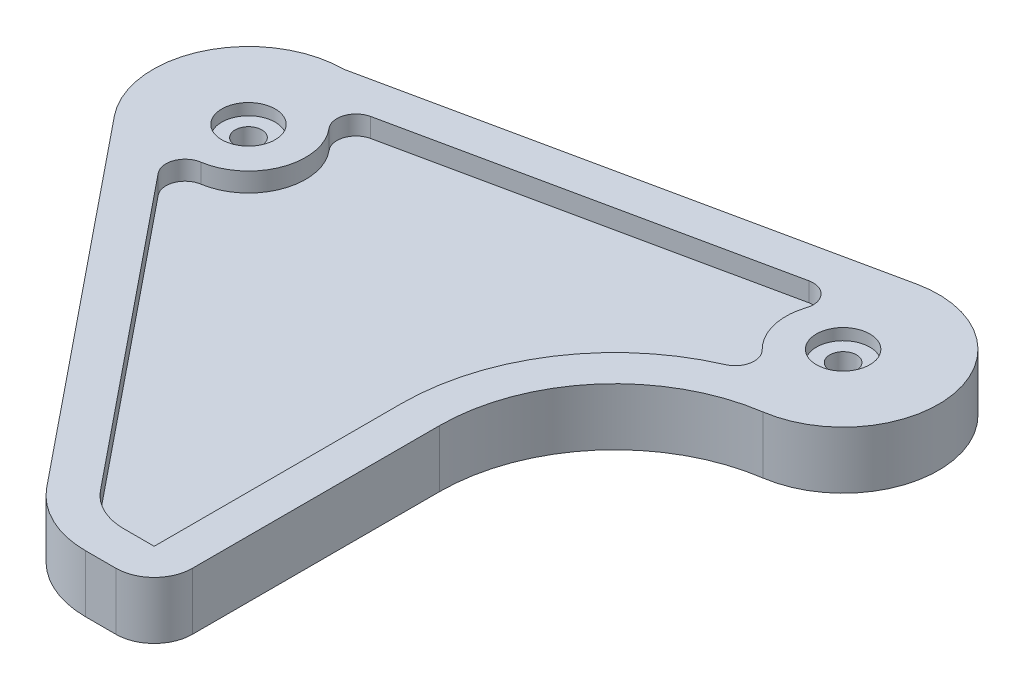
SolidWorks part; units mm, degrees
ref_plane "Front Plane" through (0, 0, 0) normal (0, 0, 1) x (1, 0, 0)
ref_plane "Top Plane" through (0, 0, 0) normal (0, 1, 0) x (1, 0, 0)
ref_plane "Right Plane" through (0, 0, 0) normal (1, 0, 0) x (0, 0, -1)
sketch "Sketch1" plane through (0, 0, 0) normal (0, 1, 0) x (1, 0, 0)
  line L0 (0, 25) -> (123.8022, 51.315)
  line L1 (55.9936, -108.8717) -> (-19.4286, -15.733)
  line L2 (75.4222, -118.1387) -> (83.4222, -118.1387)
  line L3 (93.4222, -43.3696) -> (93.4222, -108.1387)
  arc A0 (0, 25) -> (-19.4286, -15.733) centre (0, 0) ccw
  arc A1 (123.8022, 51.315) -> (132.6698, 2.1321) centre (129, 26.8613) cw
  arc A2 (132.6698, 2.1321) -> (93.4222, -43.3696) centre (139.4222, -43.3696) ccw
  arc A3 (55.9936, -108.8717) -> (75.4222, -118.1387) centre (75.4222, -93.1387) ccw
  arc A4 (83.4222, -118.1387) -> (93.4222, -108.1387) centre (83.4222, -108.1387) ccw
  point P13 (63.4979, -118.1387)
  dimension "D1" = 46
  dimension "D2" = 25
  dimension "D3" = 25
  dimension "D8" = 25
  dimension "D6" = 10
  dimension "D4" = 145
  dimension "D5" = 129
  dimension "D7" = 63
  dimension "D9" = 18
  dimension "D10" = 129
extrude "Extrude1" add sketch "Sketch1" along normal blind 15
sketch "Sketch3" plane through (0, 15, 0) normal (0, 1, 0) x (-1, 0, 0)
  line L0 (-125.8813, -41.5335) -> (-0.9186, -14.9718) construction
  line L1 (11.6572, 9.4398) -> (-63.7651, 102.5785) construction
  line L3 (-108.9393, -37.9324) -> (-14.2344, -17.8022)
  line L6 (0.757, 22.9004) -> (-63.7651, 102.5785)
  line L7 (-75.4222, 108.1387) -> (-83.4222, 108.1387)
  line L8 (-83.4222, 108.1387) -> (-83.4222, 43.3696)
  line L9 (19.4286, 15.733) -> (-55.9936, 108.8717)
  line L10 (-75.4222, 118.1387) -> (-83.4222, 118.1387)
  line L11 (-93.4222, 108.1387) -> (-93.4222, 43.3696)
  line L12 (-123.8022, -51.315) -> (0, -25)
  line L13 (19.4286, 15.733) -> (-55.9936, 108.8717)
  line L14 (-75.4222, 118.1387) -> (-83.4222, 118.1387)
  line L15 (-93.4222, 108.1387) -> (-93.4222, 43.3696)
  line L16 (-123.8022, -51.315) -> (0, -25)
  arc A0 (-14.2344, -17.8022) -> (-11.4555, -9.6836) centre (-15.274, -12.9115) ccw
  arc A1 (-2.3465, 14.8153) -> (0.757, 22.9004) centre (-3.1287, 19.7538) ccw
  arc A3 (-131.2019, -12.0238) -> (-83.4222, 43.3696) centre (-139.4222, 43.3696) ccw construction
  arc A4 (-63.7651, 102.5785) -> (-75.4222, 108.1387) centre (-75.4222, 93.1387) ccw
  arc A5 (-83.4222, 108.1387) -> (-83.4222, 108.1387) centre (-83.4222, 108.1387) ccw
  arc A6 (-117.0345, -7.9606) -> (-83.4222, 43.3696) centre (-139.4222, 43.3696) ccw
  arc A7 (-117.0345, -7.9606) -> (-118.5267, -16.123) centre (-115.0356, -12.5436) ccw
  arc A8 (0, -25) -> (19.4286, 15.733) centre (0, 0) ccw
  arc A9 (-55.9936, 108.8717) -> (-75.4222, 118.1387) centre (-75.4222, 93.1387) ccw
  arc A10 (-83.4222, 118.1387) -> (-93.4222, 108.1387) centre (-83.4222, 108.1387) ccw
  arc A11 (-132.6698, -2.1321) -> (-93.4222, 43.3696) centre (-139.4222, 43.3696) ccw
  arc A12 (-132.6698, -2.1321) -> (-123.8022, -51.315) centre (-129, -26.8613) ccw
  arc A13 (0, -25) -> (19.4286, 15.733) centre (0, 0) ccw
  arc A14 (-55.9936, 108.8717) -> (-75.4222, 118.1387) centre (-75.4222, 93.1387) ccw
  arc A15 (-83.4222, 118.1387) -> (-93.4222, 108.1387) centre (-83.4222, 108.1387) ccw
  arc A16 (-132.6698, -2.1321) -> (-93.4222, 43.3696) centre (-139.4222, 43.3696) ccw
  arc A17 (-132.6698, -2.1321) -> (-123.8022, -51.315) centre (-129, -26.8613) ccw
  arc A18 (-2.3465, 14.8153) -> (-11.4555, -9.6836) centre (0, 0) ccw
  arc A19 (-114.7342, -31.4965) -> (-118.5267, -16.123) centre (-129, -26.8613) ccw
  arc A20 (-0.9186, -14.9718) -> (11.6572, 9.4398) centre (0, 0) ccw construction
  arc A21 (-131.2019, -12.0238) -> (-125.8813, -41.5335) centre (-129, -26.8613) ccw construction
  arc A22 (-108.9393, -37.9324) -> (-114.7342, -31.4965) centre (-109.9789, -33.0416) cw
  dimension "D1" = 0
  dimension "D2" = 10
  dimension "D3" = 5
  dimension "D4" = 15
  dimension "D5" = 15
extrude "Cut-Extrude1" cut sketch "Sketch3" against normal blind 5 contours A22 L3 A0 A18 A1 L6 A4 L7 L8 A6 A7 A19
hole_wizard "C.Bore Holes" positions "Sketch8" profile "Sketch7" counterbore size "#00" standard "Ansi Inch"
sketch "Sketch8" plane through (0, 15, 0) normal (0, 1, 0) x (-1, 0, 0)
  arc A0 (0, -25) -> (19.4286, 15.733) centre (0, 0) ccw construction
  point P0 (0, 0)
  point P1 (-129, -26.8613)
sketch "Sketch7" plane through (0, 15, 0) normal (1, 0, 0) x (0, 0, 1)
  line L0 (0, 0) -> (0, 15)
  line L1 (0, 15) -> (3.5, 15)
  line L3 (3.5, 15) -> (3.5, 3)
  line L4 (3.5, 3) -> (7, 3)
  line L5 (7, 3) -> (7, 0)
  line L7 (7, 0) -> (0, 0)
  line L11 (0, -6.35) -> (0, 107.95) construction
  dimension "Thru Hole Dia." = 7
  dimension "Thru Hole Depth" = 15
  dimension "C'Bore Dia." = 14
  dimension "C'Bore Depth" = 3
